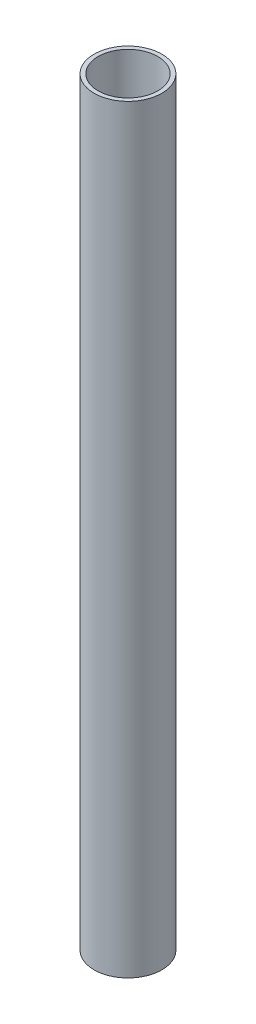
SolidWorks part; units mm, degrees
ref_plane "前视基准面" through (0, 0, 0) normal (0, 0, 1) x (1, 0, 0)
ref_plane "上视基准面" through (0, 0, 0) normal (0, 1, 0) x (1, 0, 0)
ref_plane "右视基准面" through (0, 0, 0) normal (1, 0, 0) x (0, 0, -1)
sketch "草图1" plane through (0, 0, 0) normal (0, 1, 0) x (1, 0, 0)
  circle A0 centre (0, 0) radius 25
  circle A1 centre (0, 0) radius 22
  dimension "D1" = 50
  dimension "D2" = 3
extrude "凸台-拉伸1" add sketch "草图1" along normal blind 560
